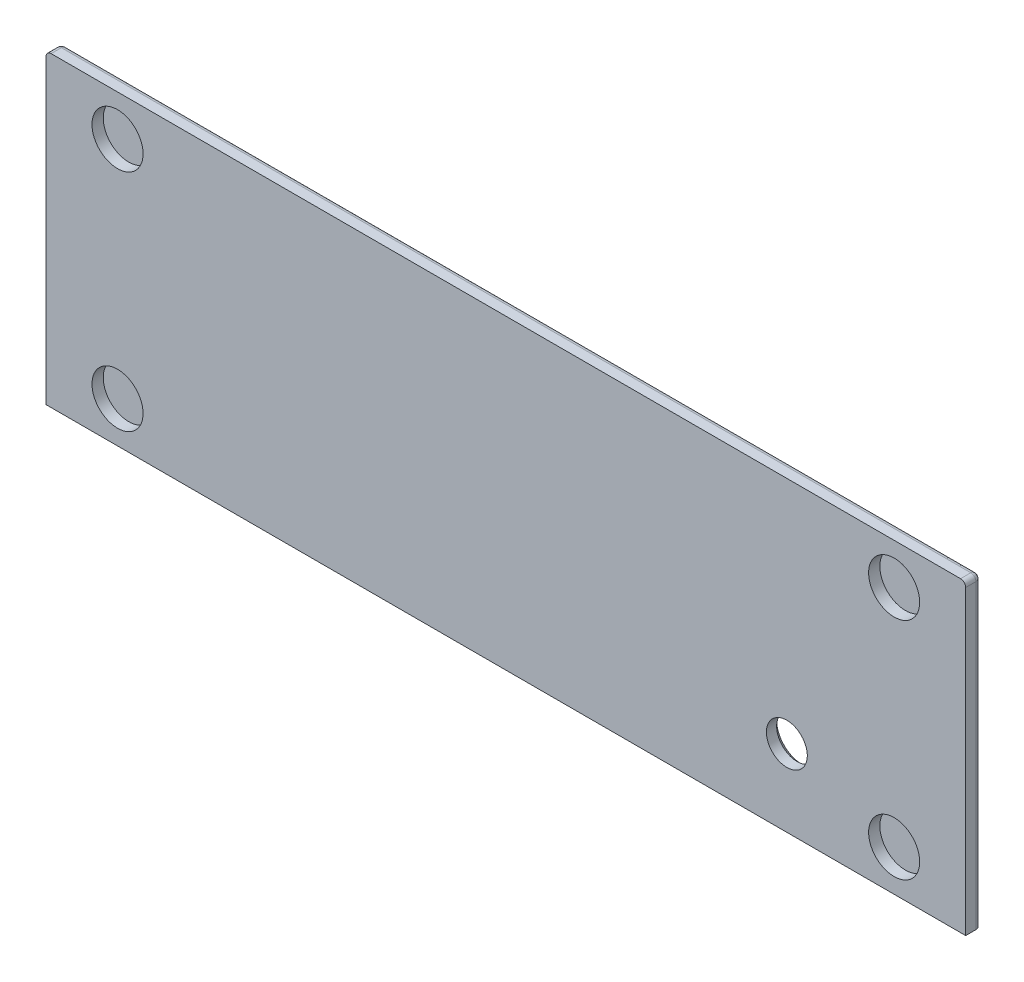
SolidWorks part; units mm, degrees
ref_plane "Ebene vorne" through (0, 0, 0) normal (0, 0, 1) x (1, 0, 0)
ref_plane "Ebene oben" through (0, 0, 0) normal (0, 1, 0) x (1, 0, 0)
ref_plane "Ebene rechts" through (0, 0, 0) normal (1, 0, 0) x (0, 0, -1)
sketch "Skizze1" plane through (0, 0, 0) normal (0, 0, 1) x (1, 0, 0)
  line L1 (-90, -30) -> (90, -30)
  line L2 (-90, -30) -> (-90, 30)
  line L3 (-90, 30) -> (90, 30)
  line L4 (90, -30) -> (90, 30)
  line L5 (-90, -30) -> (90, 30) construction
  line L6 (-90, 30) -> (90, -30) construction
  point P0 (0, 0)
  dimension "D1" = 180
  dimension "D2" = 60
extrude "Aufsatz-Linear austragen1" add sketch "Skizze1" along normal blind 3
sketch "Skizze2" plane through (0, 0, 3) normal (0, 0, 1) x (1, 0, 0)
  line L0 (-90, 30) -> (-90, -30) construction
  line L1 (90, -30) -> (90, 30) construction
  line L2 (90, 30) -> (-90, 30) construction
  line L3 (-90, -30) -> (90, -30) construction
  circle A0 centre (-76, 22) radius 5
  circle A1 centre (-76, -22) radius 5
  circle A2 centre (76, -22) radius 5
  circle A3 centre (76, 22) radius 5
  dimension "D1" = 10
  dimension "D2" = 10
  dimension "D3" = 10
  dimension "D4" = 10
  dimension "D5" = 14
  dimension "D6" = 14
  dimension "D7" = 14
  dimension "D8" = 14
  dimension "D9" = 8
  dimension "D10" = 8
  dimension "D11" = 8
  dimension "D12" = 8
extrude "Schnitt-Linear austragen1" cut sketch "Skizze2" against normal blind 2.2
fillet "Verrundung1" radius 1 5 edges at (-90, 30, 1.5) (-90, 0, 0) (90, 0, 0) (0, 30, 0) (90, 30, 1.5)
sketch "Skizze3" plane through (0, 0, 0) normal (0, 0, -1) x (-1, 0, 0)
  line L0 (-90, -30) -> (-90, 29) construction
  line L1 (89, -30) -> (-89, -30) construction
  circle A0 centre (-55, -15) radius 4
  dimension "D1" = 8
  dimension "D3" = 15
  dimension "D2" = 35
extrude "Schnitt-Linear austragen2" cut sketch "Skizze3" against normal blind 10
chamfer "Fase1" distance 1 angle 45 1 edges at (51, -15, 0)
